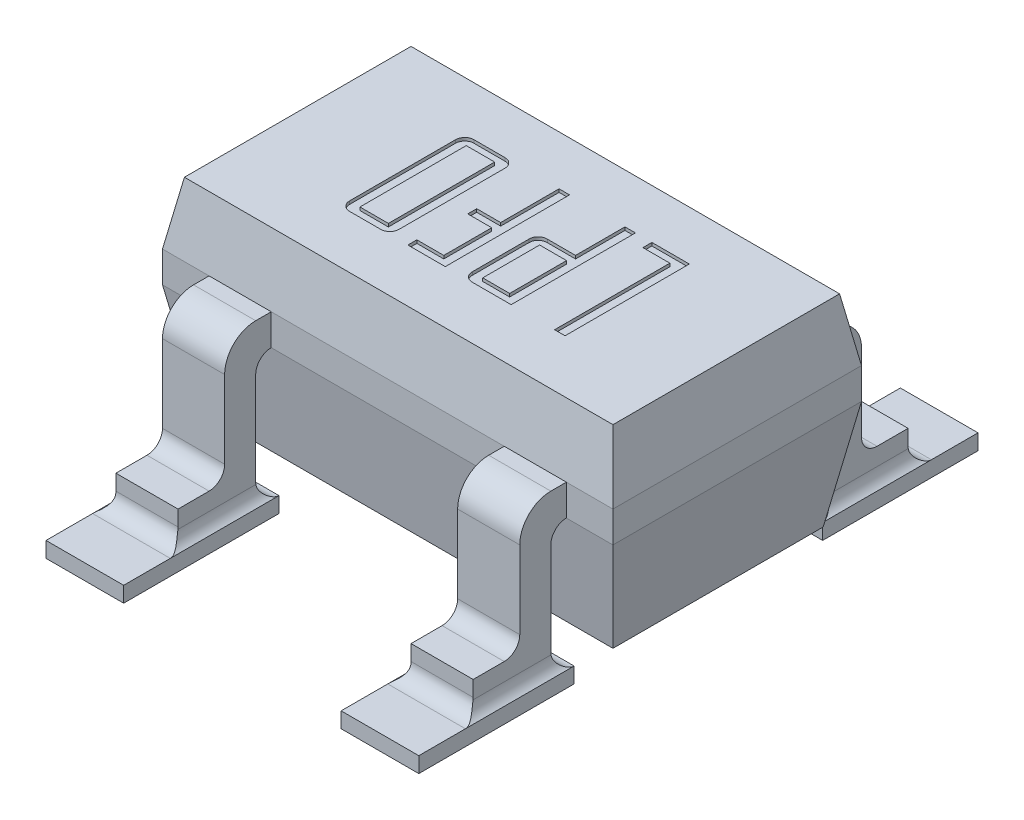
SolidWorks part; units mm, degrees
ref_plane "Plan de face" through (0, 0, 0) normal (0, 0, 1) x (1, 0, 0)
ref_plane "Plan de dessus" through (0, 0, 0) normal (0, 1, 0) x (1, 0, 0)
ref_plane "Plan de droite" through (0, 0, 0) normal (1, 0, 0) x (0, 0, -1)
sketch "Esquisse1" plane through (0, 0, 0) normal (0, 1, 0) x (1, 0, 0)
  line L1 (-1.45, 0.8) -> (1.45, 0.8)
  line L2 (-1.45, 0.8) -> (-1.45, -0.8)
  line L3 (-1.45, -0.8) -> (1.45, -0.8)
  line L4 (1.45, 0.8) -> (1.45, -0.8)
  point P4 (-1.45, 0)
  point P6 (0, -0.8)
  dimension "D1" = 2.9
  dimension "D2" = 1.6
extrude "Boss.-Extru.1" add sketch "Esquisse1" along normal blind 0.2
sketch "Esquisse2" plane through (0, 0, 0.8) normal (0, 0, 1) x (1, 0, 0)
  line L0 (-1.45, 0.2) -> (-1.3795, 0.6)
  line L1 (-1.3795, 0.6) -> (1.3795, 0.6)
  line L2 (1.3795, 0.6) -> (1.45, 0.2)
  line L3 (1.45, 0.2) -> (-1.45, 0.2)
  line L4 (-1.45, 0) -> (-1.3266, -0.7)
  line L5 (-1.3266, -0.7) -> (1.3266, -0.7)
  line L6 (1.3266, -0.7) -> (1.45, 0)
  line L7 (1.45, 0) -> (-1.45, 0)
  dimension "D1" = 0.4
  dimension "D2" = 0.7
  dimension "D3" = 80
  dimension "D4" = 80
extrude "Boss.-Extru.2" add sketch "Esquisse2" against normal up to surface (1.6 mm away)
sketch "Esquisse3" plane through (1.45, 0, 0) normal (1, 0, 0) x (0, 0, -1)
  line L0 (-0.8, 0.2) -> (-0.8, 0.6)
  line L1 (-0.8, 0.6) -> (-0.7295, 0.6)
  line L2 (0.8, 0.6) -> (-0.8, 0.6) construction
  line L3 (-0.7295, 0.6) -> (-0.8, 0.2)
  line L4 (-0.8, 0) -> (-0.8, -0.7)
  line L5 (-0.8, -0.7) -> (-0.6766, -0.7)
  line L6 (0.8, -0.7) -> (-0.8, -0.7) construction
  line L7 (-0.6766, -0.7) -> (-0.8, 0)
  line L8 (0.8, 0.2) -> (0.7295, 0.6)
  line L9 (0.7295, 0.6) -> (0.8, 0.6)
  line L10 (0.8, 0.6) -> (0.8, 0.2)
  line L11 (0.8, 0) -> (0.8, -0.7)
  line L12 (0.8, -0.7) -> (0.6766, -0.7)
  line L13 (0.6766, -0.7) -> (0.8, 0)
  line L14 (-0.8, 0.2) -> (0.8, 0.2) construction
  line L15 (-0.8, 0) -> (0.8, 0) construction
  dimension "D1" = 80
  dimension "D2" = 80
extrude "Enlèv. mat.-Extru.1" cut sketch "Esquisse3" against normal through all
sketch "Esquisse4" plane through (0, 0, -0.8) normal (0, 0, -1) x (-1, 0, 0)
  line L0 (1.45, 0.2) -> (-1.45, 0.2) construction
  line L1 (-1.15, 0.2) -> (-0.75, 0.2)
  line L2 (-1.15, 0.2) -> (-1.15, 0)
  line L3 (-1.15, 0) -> (-0.75, 0)
  line L4 (-0.75, 0.2) -> (-0.75, 0)
  line L5 (1.45, 0) -> (-1.45, 0) construction
  line L7 (-0.2, 0.2) -> (0.2, 0.2)
  line L8 (-0.2, 0.2) -> (-0.2, 0)
  line L9 (-0.2, 0) -> (0.2, 0)
  line L10 (0.2, 0.2) -> (0.2, 0)
  line L11 (0.75, 0.2) -> (1.15, 0.2)
  line L12 (0.75, 0.2) -> (0.75, 0)
  line L13 (0.75, 0) -> (1.15, 0)
  line L14 (1.15, 0.2) -> (1.15, 0)
  point P16 (0, 0)
  dimension "D1" = 0.4
  dimension "D2" = 0.55
  dimension "D3" = 0.55
extrude "Boss.-Extru.3" add sketch "Esquisse4" along normal blind 0.3
sketch "Esquisse5" plane through (0, 0, 0.8) normal (0, 0, 1) x (1, 0, 0)
  line L0 (-1.45, 0.2) -> (1.45, 0.2) construction
  line L1 (-1.15, 0.2) -> (-0.75, 0.2)
  line L2 (-1.15, 0.2) -> (-1.15, 0)
  line L3 (-1.15, 0) -> (-0.75, 0)
  line L4 (-0.75, 0.2) -> (-0.75, 0)
  line L5 (-1.45, 0) -> (1.45, 0) construction
  line L7 (0.75, 0.2) -> (1.15, 0.2)
  line L8 (0.75, 0.2) -> (0.75, 0)
  line L9 (0.75, 0) -> (1.15, 0)
  line L10 (1.15, 0.2) -> (1.15, 0)
  dimension "D1" = 0.4
  dimension "D2" = 0.4
  dimension "D3" = 0.75
  dimension "D4" = 0.75
extrude "Boss.-Extru.4" add sketch "Esquisse5" along normal blind 0.3
sketch "Esquisse6" plane through (0, 0, 0) normal (0, -1, 0) x (1, 0, 0)
  line L0 (-0.75, 1.1) -> (-0.75, 0.8) construction
  line L1 (-1.15, 1.1) -> (-0.75, 1.1)
  line L2 (-1.15, 1.1) -> (-1.15, 0.9)
  line L3 (-1.15, 0.9) -> (-0.75, 0.9)
  line L4 (-0.75, 1.1) -> (-0.75, 0.9)
  line L5 (1.15, 1.1) -> (1.15, 0.8) construction
  line L6 (0.75, 1.1) -> (1.15, 1.1)
  line L7 (0.75, 1.1) -> (0.75, 0.9)
  line L8 (0.75, 0.9) -> (1.15, 0.9)
  line L9 (1.15, 1.1) -> (1.15, 0.9)
  line L10 (-0.75, -1.1) -> (-0.75, -0.8) construction
  line L11 (-1.15, -1.1) -> (-0.75, -1.1)
  line L12 (-1.15, -1.1) -> (-1.15, -0.9)
  line L13 (-1.15, -0.9) -> (-0.75, -0.9)
  line L14 (-0.75, -1.1) -> (-0.75, -0.9)
  line L15 (0.2, -1.1) -> (0.2, -0.8) construction
  line L16 (-0.2, -1.1) -> (0.2, -1.1)
  line L17 (-0.2, -1.1) -> (-0.2, -0.9)
  line L18 (-0.2, -0.9) -> (0.2, -0.9)
  line L19 (0.2, -1.1) -> (0.2, -0.9)
  line L20 (1.15, -1.1) -> (1.15, -0.8) construction
  line L21 (0.75, -1.1) -> (1.15, -1.1)
  line L22 (0.75, -1.1) -> (0.75, -0.9)
  line L23 (0.75, -0.9) -> (1.15, -0.9)
  line L24 (1.15, -1.1) -> (1.15, -0.9)
  dimension "D1" = 0.2
extrude "Boss.-Extru.5" add sketch "Esquisse6" along normal blind 0.6
sketch "Esquisse7" plane through (0, -0.6, 0) normal (0, -1, 0) x (1, 0, 0)
  line L0 (-0.75, 0.9) -> (-0.75, 0.8) construction
  line L1 (-1.15, 0.9) -> (-0.75, 0.9)
  line L2 (-1.15, 0.9) -> (-1.15, 1.4)
  line L3 (-1.15, 1.4) -> (-0.75, 1.4)
  line L4 (-0.75, 0.9) -> (-0.75, 1.4)
  line L5 (0.75, 0.9) -> (1.15, 0.9)
  line L6 (0.75, 0.9) -> (0.75, 1.4)
  line L7 (0.75, 1.4) -> (1.15, 1.4)
  line L8 (1.15, 0.9) -> (1.15, 1.4)
  line L9 (-1.15, -0.9) -> (-0.75, -0.9)
  line L10 (-1.15, -0.9) -> (-1.15, -1.4)
  line L11 (-1.15, -1.4) -> (-0.75, -1.4)
  line L12 (-0.75, -0.9) -> (-0.75, -1.4)
  line L13 (-0.2, -0.9) -> (0.2, -0.9)
  line L14 (-0.2, -0.9) -> (-0.2, -1.4)
  line L15 (-0.2, -1.4) -> (0.2, -1.4)
  line L16 (0.2, -0.9) -> (0.2, -1.4)
  line L17 (0.75, -0.9) -> (1.15, -0.9)
  line L18 (0.75, -0.9) -> (0.75, -1.4)
  line L19 (0.75, -1.4) -> (1.15, -1.4)
  line L20 (1.15, -0.9) -> (1.15, -1.4)
  line L21 (1.15, 0.9) -> (1.15, 1.1) construction
  line L22 (-0.75, -0.9) -> (-0.75, -0.8) construction
  line L23 (0.2, -0.9) -> (0.2, -0.8) construction
  line L24 (1.15, -0.9) -> (1.15, -0.8) construction
  dimension "D1" = 0.5
extrude "Boss.-Extru.6" add sketch "Esquisse7" along normal blind 0.2
sketch "Esquisse8" plane through (0, -0.8, 0) normal (0, -1, 0) x (1, 0, 0)
  line L0 (-1.15, 0.9) -> (-0.75, 0.9) construction
  line L1 (-1.2, 0.8) -> (-0.7, 0.8)
  line L2 (-1.2, 0.8) -> (-1.2, 1.8)
  line L3 (-1.2, 1.8) -> (-0.7, 1.8)
  line L4 (-0.7, 0.8) -> (-0.7, 1.8)
  line L5 (0.7, 0.8) -> (1.2, 0.8)
  line L6 (0.7, 0.8) -> (0.7, 1.8)
  line L7 (0.7, 1.8) -> (1.2, 1.8)
  line L8 (1.2, 0.8) -> (1.2, 1.8)
  line L9 (-1.2, -0.8) -> (-0.7, -0.8)
  line L10 (-1.2, -0.8) -> (-1.2, -1.8)
  line L11 (-1.2, -1.8) -> (-0.7, -1.8)
  line L12 (-0.7, -0.8) -> (-0.7, -1.8)
  line L13 (-0.25, -0.8) -> (0.25, -0.8)
  line L14 (-0.25, -0.8) -> (-0.25, -1.8)
  line L15 (-0.25, -1.8) -> (0.25, -1.8)
  line L16 (0.25, -0.8) -> (0.25, -1.8)
  line L17 (0.7, -0.8) -> (1.2, -0.8)
  line L18 (0.7, -0.8) -> (0.7, -1.8)
  line L19 (0.7, -1.8) -> (1.2, -1.8)
  line L20 (1.2, -0.8) -> (1.2, -1.8)
  line L21 (-0.75, -0.9) -> (-1.15, -0.9) construction
  line L22 (1.15, -0.8) -> (0.75, -0.8) construction
  line L23 (-1.15, 1.4) -> (-1.2, 1.8) construction
  line L24 (-0.75, 1.4) -> (-0.7, 1.8) construction
  line L25 (0.75, 1.4) -> (0.7, 1.8) construction
  line L26 (1.15, 1.4) -> (1.2, 1.8) construction
  line L27 (-1.15, -1.4) -> (-1.2, -1.8) construction
  line L28 (-0.75, -1.4) -> (-0.7, -1.8) construction
  line L29 (-0.2, -1.4) -> (-0.25, -1.8) construction
  line L30 (0.2, -1.4) -> (0.25, -1.8) construction
  line L31 (0.75, -1.4) -> (0.7, -1.8) construction
  line L32 (1.15, -1.4) -> (1.2, -1.8) construction
  dimension "D1" = 1
  dimension "D2" = 0.1
  dimension "D3" = 1
  dimension "D4" = 0.1
  dimension "D5" = 0.5
extrude "Boss.-Extru.7" add sketch "Esquisse8" along normal blind 0.1
fillet "Congé1" radius 0.1 10 edges at (-0.95, 0, -0.9) (0, 0, -0.9) (0.95, 0, -0.9) (0.95, 0, 0.9) (-0.95, 0, 0.9)
fillet "Congé2" radius 0.2 5 edges at (-0.95, 0.2, -1.1) (0, 0.2, -1.1) (0.95, 0.2, -1.1) (0.95, 0.2, 1.1) (-0.95, 0.2, 1.1)
fillet "Congé4" radius 0.1 20 edges at (1.15, -0.8, 1.15) (0.95, -0.8, 0.9) (-0.75, -0.8, 1.15) (-0.95, -0.8, 0.9) (-1.15, -0.8, 1.15) (-0.95, -0.8, 1.4) (0.75, -0.8, 1.15) (0.95, -0.8, 1.4) (0.75, -0.8, -1.15) (-0.2, -0.8, -1.15) (-1.15, -0.8, -1.15) (-0.95, -0.8, -0.9) (0, -0.8, -0.9) (0.95, -0.8, -0.9) (1.15, -0.8, -1.15) (0.95, -0.8, -1.4) (0.2, -0.8, -1.15) (0, -0.8, -1.4) (-0.75, -0.8, -1.15) (-0.95, -0.8, -1.4)
sketch "Esquisse9" plane through (0, 0.6, 0) normal (0, 1, 0) x (1, 0, 0)
  line L0 (-0.7835, 0.4119) -> (0.892, 0.4119) construction
  text T0 "LPF0" font "Agency FB" height 0.8
extrude "Enlèv. mat.-Extru.2" cut sketch "Esquisse9" against normal blind 0.02
